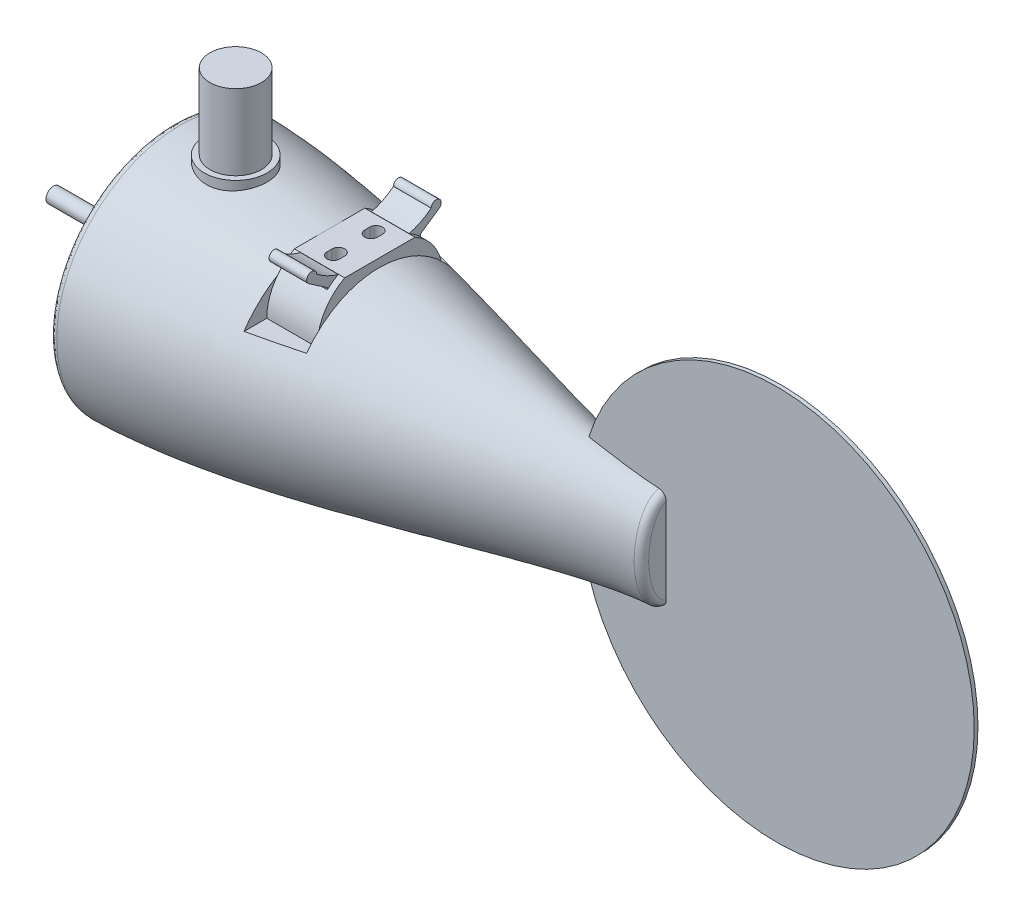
SolidWorks part; units mm, degrees
ref_plane "Front Plane" through (0, 0, 0) normal (0, 0, 1) x (1, 0, 0)
ref_plane "Top Plane" through (0, 0, 0) normal (0, 1, 0) x (1, 0, 0)
ref_plane "Right Plane" through (0, 0, 0) normal (1, 0, 0) x (0, 0, -1)
sketch "Sketch3" plane through (0, 0, 0) normal (1, 0, 0) x (0, 0, -1)
  circle A0 centre (0, 0) radius 25.019
  dimension "D1" = 50.038
ref_plane "Plane1" through (100.076, 0, 0) normal (1, 0, 0) x (0, 0, -1)
sketch "Sketch4" plane through (100.076, 0, 0) normal (1, 0, 0) x (0, 0, -1)
  ellipse E0 centre (0, 0) end of major axis (0, 10.16) minor radius 5.3975
  dimension "D1" = 10.795
  dimension "D2" = 20.32
loft "Loft1" add profiles "Sketch3", "Sketch4"
fillet "Fillet1" radius 1.524 2 edges at (0, 0, -25.019) (100.076, 10.16, 0)
sketch "Sketch5" plane through (0, 0, 0) normal (0, 1, 0) x (1, 0, 0)
  circle A0 centre (12.7, 0) radius 6.35
  dimension "D2" = 12.7
  dimension "D1" = 12.7
extrude "Boss-Extrude1" add sketch "Sketch5" along normal blind 25.4
sketch "Sketch6" plane through (0, 25.4, 0) normal (0, 1, 0) x (1, 0, 0)
  circle A0 centre (12.7, 0) radius 5.207
  dimension "D1" = 10.414
extrude "Boss-Extrude2" add sketch "Sketch6" along normal blind 15.24
sketch "Sketch7" plane through (0, 0, 0) normal (-1, 0, 0) x (0, 0, 1)
  circle A0 centre (0, 0) radius 1.4986
  dimension "D1" = 2.9972
extrude "Boss-Extrude3" add sketch "Sketch7" along normal blind 24.13
sketch "Sketch8" plane through (0, 0, 0) normal (0, 0, 1) x (1, 0, 0)
  circle A0 centre (122.428, 0) radius 39.878
  dimension "D2" = 79.756
  dimension "D1" = 162.306
extrude "Boss-Extrude4" add sketch "Sketch8" along normal mid plane 0.762
sketch "Sketch9" plane through (0, 0, 0) normal (0, 0, 1) x (1, 0, 0)
  line L0 (0, 23.4854) -> (0, -23.4854) construction
  line L1 (31.75, 40.64) -> (41.91, 40.64)
  line L2 (31.75, 40.64) -> (31.75, 12.7)
  line L3 (31.75, 12.7) -> (41.91, 12.7)
  line L4 (41.91, 40.64) -> (41.91, 12.7)
  line L5 (17.907, 25.4) -> (7.493, 25.4) construction
  line L6 (17.907, 40.64) -> (7.493, 40.64) construction
  dimension "D1" = 31.75
  dimension "D2" = 10.16
  dimension "D3" = 12.7
extrude "Cut-Extrude1" cut sketch "Sketch9" against normal through all and the other way through all
sketch "Sketch10" plane through (31.75, 0, 0) normal (1, 0, 0) x (0, 0, -1)
  line L0 (-0.0746, 12.7) -> (-0.0746, 31.4237) construction
  line L1 (17.2156, 12.7) -> (-17.3648, 12.7) construction
  line L2 (12.6254, 12.7) -> (-12.7746, 12.7)
  line L3 (-7.1866, 22.0618) -> (7.0374, 22.0618)
  arc A0 (-12.7746, 12.7) -> (-7.1866, 22.0618) centre (-2.1384, 12.7) cw
  arc A1 (12.6254, 12.7) -> (7.0374, 22.0618) centre (1.9893, 12.7) ccw
  spline S0 degree 3 poles (17.2156, 12.7) (16.2454, 14.1209) (15.1321, 15.4038) (13.5641, 16.8373) (13.2416, 17.1154) (12.5782, 17.6538) (12.2364, 17.9149) (11.1892, 18.6658) (10.4681, 19.1195) (8.9807, 19.9351) (8.2145, 20.297) (7.0303, 20.769) (6.6298, 20.9145) (5.8169, 21.1813) (5.4029, 21.3029) (3.327, 21.8417) (1.6439, 22.0569) (-0.9136, 22.0642) (-1.7774, 22.013) (-3.4734, 21.8043) (-4.3086, 21.6475) (-5.9539, 21.2303) (-6.764, 20.9698) (-7.9598, 20.4997) (-8.3563, 20.3291) (-9.1326, 19.9657) (-9.5134, 19.7726) (-10.6342, 19.1599) (-11.3528, 18.7072) (-12.7341, 17.7152) (-13.3981, 17.1747) (-15.2964, 15.4281) (-16.4063, 14.1294) (-17.3648, 12.7) knots 0 0 0 0 0.125 0.125 0.15625 0.15625 0.1875 0.1875 0.25 0.25 0.3125 0.3125 0.34375 0.34375 0.375 0.375 0.5 0.5 0.5625 0.5625 0.625 0.625 0.6875 0.6875 0.71875 0.71875 0.75 0.75 0.8125 0.8125 0.875 0.875 1 1 1 1 construction
  point P13 (-0.0746, 22.0618)
  dimension "D1" = 14.224
  dimension "D2" = 25.4
extrude "Boss-Extrude5" add sketch "Sketch10" along normal up to vertex separate body
sketch "Sketch11" plane through (0, 22.0618, 0) normal (0, 1, 0) x (1, 0, 0)
  line L0 (36.83, 3.2274) -> (36.83, 4.2434) construction
  line L1 (35.56, 3.2274) -> (35.56, 4.2434)
  line L2 (38.1, 3.2274) -> (38.1, 4.2434)
  line L3 (31.75, -0.0746) -> (41.91, -0.0746) construction
  line L4 (31.75, -17.3648) -> (31.75, 17.2156) construction
  line L5 (41.91, 14.6482) -> (41.91, -14.889) construction
  line L6 (36.83, -3.3766) -> (36.83, -4.3926) construction
  line L7 (35.56, -3.3766) -> (35.56, -4.3926)
  line L8 (38.1, -3.3766) -> (38.1, -4.3926)
  arc A0 (35.56, 3.2274) -> (38.1, 3.2274) centre (36.83, 3.2274) ccw
  arc A1 (38.1, 4.2434) -> (35.56, 4.2434) centre (36.83, 4.2434) ccw
  arc A2 (35.56, -3.3766) -> (38.1, -3.3766) centre (36.83, -3.3766) cw
  arc A3 (38.1, -4.3926) -> (35.56, -4.3926) centre (36.83, -4.3926) cw
  point P2 (36.83, 3.7354)
  point P14 (36.83, -0.0746)
  point P16 (36.83, -3.8846)
  dimension "D1" = 2.54
  dimension "D2" = 1.016
  dimension "D3" = 7.62
extrude "Cut-Extrude2" cut sketch "Sketch11" against normal blind 2.54
ref_plane "Plane2" through (36.83, 0, 0) normal (1, 0, 0) x (0, 0, -1)
sketch "Sketch12" plane through (36.83, 0, 0) normal (1, 0, 0) x (0, 0, -1)
  line L0 (7.1237, 22.0148) -> (7.1237, 20.32)
  line L1 (7.1237, 20.32) -> (9.4097, 20.32)
  line L2 (9.4097, 20.32) -> (9.4097, 20.828)
  line L3 (9.4097, 20.828) -> (13.1463, 23.3821)
  line L4 (7.0374, 22.0618) -> (-7.1866, 22.0618) construction
  line L6 (0, 0) -> (0, 41.762) construction
  line L7 (17.2156, 12.7) -> (-17.3648, 12.7) construction
  arc A1 (12.6254, 12.7) -> (7.0374, 22.0618) centre (1.9893, 12.7) ccw construction
  arc A2 (13.1463, 23.3821) -> (11.5574, 24.2492) centre (12.573, 24.2208) ccw
  arc A3 (7.1237, 22.0148) -> (11.5574, 24.2492) centre (3.7352, 34.2544) ccw
  point P11 (12.573, 25.2368)
  point P18 (13.589, 24.2208)
  dimension "D5" = 1.016
  dimension "D1" = 0.508
  dimension "D2" = 27.178
  dimension "D3" = 7.62
  dimension "D4" = 2.286
  dimension "D6" = 3.175
extrude "Boss-Extrude7" add sketch "Sketch12" along normal mid plane 7.62 separate body
mirror "Mirror1" about plane through (0, 0, 0) normal (0, 0, 1)
